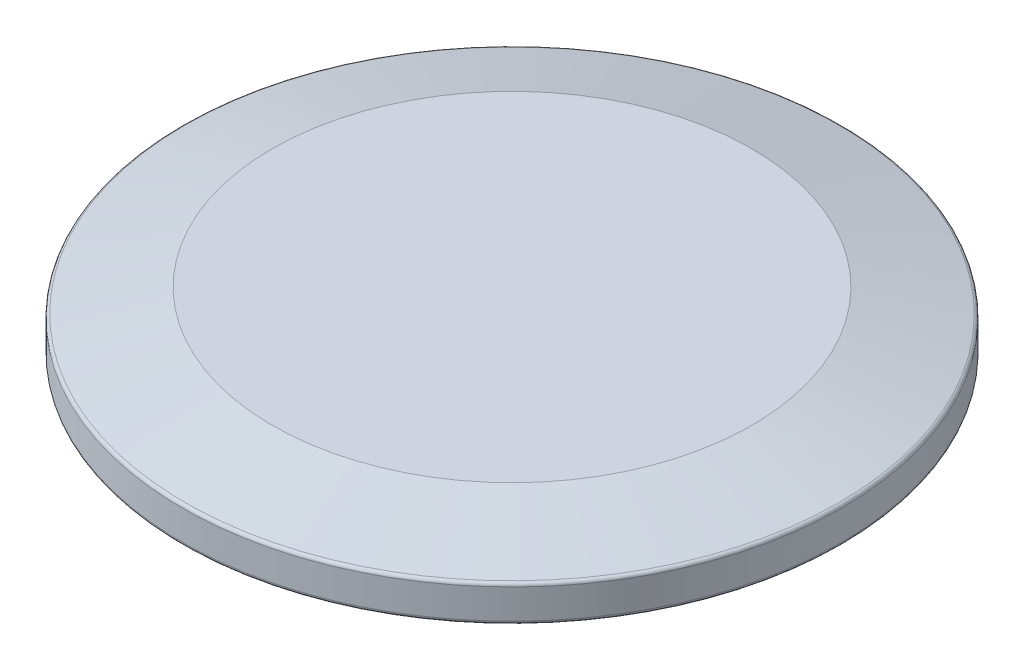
SolidWorks part; units mm, degrees
ref_plane "前视基准面" through (0, 0, 0) normal (0, 0, 1) x (1, 0, 0)
ref_plane "上视基准面" through (0, 0, 0) normal (0, 1, 0) x (1, 0, 0)
ref_plane "右视基准面" through (0, 0, 0) normal (1, 0, 0) x (0, 0, -1)
other "Configuration Table"
sketch "草图1" plane through (0, 0, 0) normal (0, 0, 1) x (1, 0, 0)
  line L0 (0, 0) -> (-17.5, 0)
  line L1 (-17.5, 0) -> (-20.7, 0)
  line L2 (-20.7, 0) -> (-27.5, 0)
  line L3 (-27.5, 0) -> (-27.5, 3)
  line L4 (-27.5, 3) -> (-20, 5)
  line L5 (-20, 5) -> (0, 5)
  line L6 (0, 5) -> (0, 0)
  line L7 (-20.7, 0) -> (-20.7, 2.5)
  line L8 (-20.7, 2.5) -> (-17.5, 2.5)
  line L9 (-17.5, 2.5) -> (-17.5, 0)
  dimension "D1" = 17.5
  dimension "D2" = 3.2
  dimension "D3" = 6.8
  dimension "D4" = 3
  dimension "D5" = 5
  dimension "D6" = 2.5
  dimension "D7" = 20
revolve "旋转1" add sketch "草图1" angle 360 about L6
fillet "圆角1" radius 0.3 1 edges at (-27.5, 3, 0)
fillet "圆角2" radius 0.3 1 edges at (-27.5, 0, 0)
fillet "圆角3" radius 0.3 1 edges at (-20.7, 0, 0)
